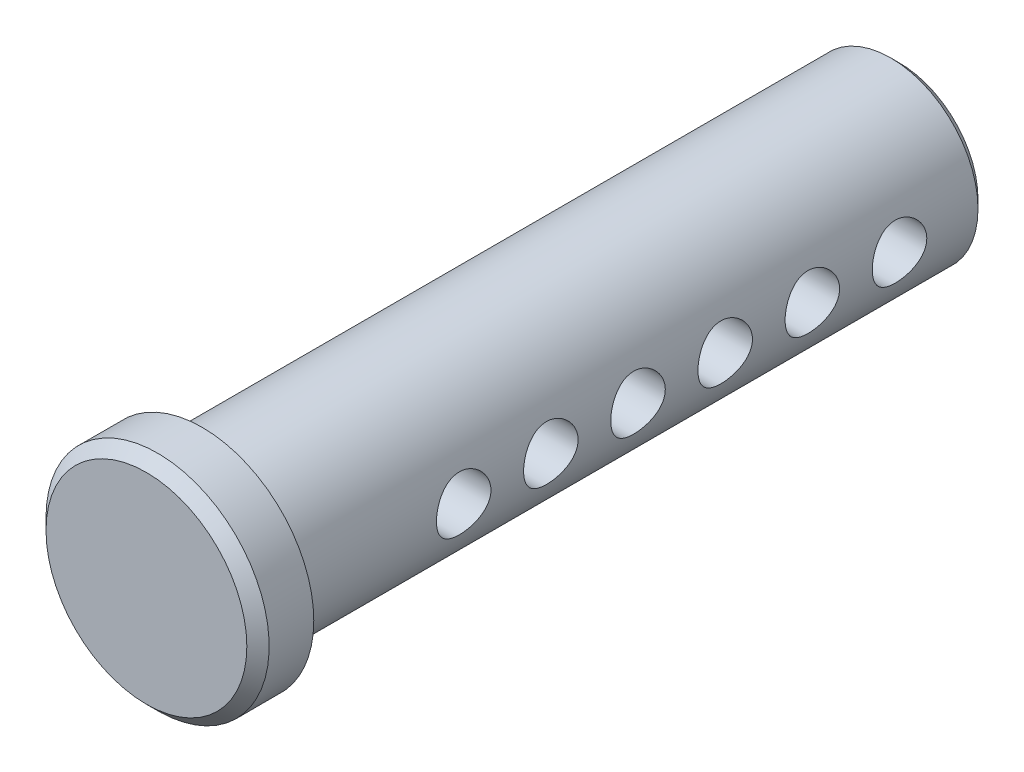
SolidWorks part; units mm, degrees
ref_plane "Front" through (0, 0, 0) normal (0, 0, 1) x (1, 0, 0)
ref_plane "Top" through (0, 0, 0) normal (0, 1, 0) x (1, 0, 0)
ref_plane "Right" through (0, 0, 0) normal (1, 0, 0) x (0, 0, -1)
sketch "Sketch1" plane through (0, 0, 0) normal (0, 0, 1) x (1, 0, 0)
  circle A0 centre (0, 0) radius 6.35
  point P3 (0, 6.35)
  point P4 (0, -6.35)
  dimension "dia" = 12.7
extrude "Extrude1" add sketch "Sketch1" along normal mid plane 50.8
sketch "Sketch2" plane through (0, 0, 25.4) normal (0, 0, 1) x (1, 0, 0)
  circle A0 centre (0, 0) radius 8.128
  dimension "head dia" = 16.256
extrude "Extrude2" add sketch "Sketch2" along normal blind 4.064
chamfer "Chamfer1" distance 0.8128 angle 45 1 edges at (8.128, 0, 29.464)
sketch "Sketch3" plane through (0, 0, 0) normal (1, 0, 0) x (0, 0, -1)
  line L1 (25.4, -6.35) -> (25.4, 6.35) construction
  circle A0 centre (19.05, 0) radius 1.9844
  point P2 (17.0656, 0)
  dimension "D1" = 6.35
  dimension "hole dia" = 3.9688
extrude "Extrude3" cut sketch "Sketch3" against normal through all and the other way through all
pattern_linear "LPattern1" count 6 spacing 6.35 along (0, 0, 1) of "Extrude3"
chamfer "Chamfer2" distance 0.635 angle 45 1 edges at (6.35, 0, -25.4)
ref_plane "Plane1" through (0, 0, -19.05) normal (0, 0, 1) x (1, 0, 0)
sketch "Sketch8" plane through (0, 0, 0) normal (1, 0, 0) x (0, 0, -1)
  line L0 (-29.464, 7.3152) -> (-29.464, -7.3152) construction
  line L1 (-28.6512, -8.128) -> (-25.4, -8.128) construction
  line L2 (25.4, -5.715) -> (25.4, 5.715) construction
  circle A0 centre (12.7, 0) radius 1.9844 construction
  circle A1 centre (19.05, 0) radius 1.9844 construction
  point P0 (-29.464, 8.128)
  point P1 (-25.4, 8.128)
  point P5 (25.4, 6.35)
  point P8 (-29.464, -8.128)
  point P9 (25.4, -6.35)
  point P12 (19.05, 0)
  point P13 (12.7, 0)
  point P17 (12.7, -1.9844)
  point P19 (19.05, -1.9844)
equation "\"D1@Chamfer1\" = \"head ht@Extrude2\" * .2"
equation "\"D1@Chamfer2\" = \"dia@Sketch1\" * .05"
